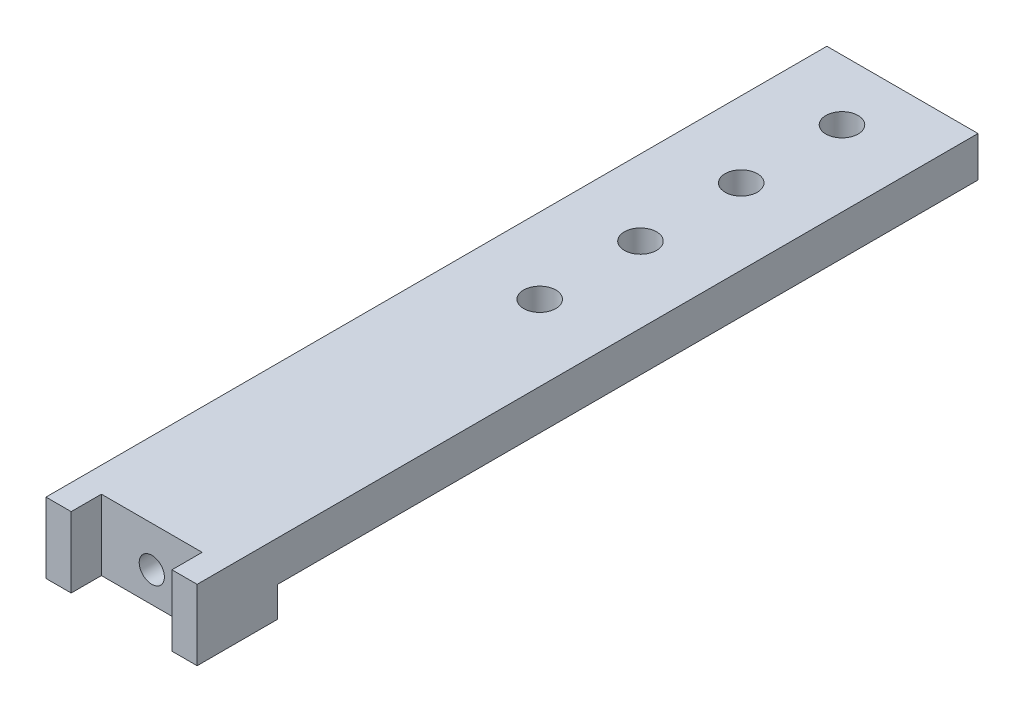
SolidWorks part; units mm, degrees
ref_plane "前视基准面" through (0, 0, 0) normal (0, 0, 1) x (1, 0, 0)
ref_plane "上视基准面" through (0, 0, 0) normal (0, 1, 0) x (1, 0, 0)
ref_plane "右视基准面" through (0, 0, 0) normal (1, 0, 0) x (0, 0, -1)
sketch "草图1" plane through (0, 0, 0) normal (0, 1, 0) x (1, 0, 0)
  line L1 (-7.5, 37.25) -> (7.5, 37.25)
  line L2 (-7.5, 37.25) -> (-7.5, -37.25)
  line L3 (-7.5, -37.25) -> (7.5, -37.25)
  line L4 (7.5, 37.25) -> (7.5, -37.25)
  line L5 (-7.5, 37.25) -> (7.5, -37.25) construction
  line L6 (-7.5, -37.25) -> (7.5, 37.25) construction
  point P0 (0, 0)
  dimension "D1" = 15
  dimension "D2" = 74.5
extrude "凸台-拉伸1" add sketch "草图1" along normal blind 4
sketch "草图2" plane through (0, 0, 0) normal (0, 1, 0) x (1, 0, 0)
  line L1 (-5, 37.25) -> (5, 37.25)
  line L2 (-5, 37.25) -> (-5, -2.75)
  line L3 (-5, -2.75) -> (5, -2.75)
  line L4 (5, 37.25) -> (5, -2.75)
  line L5 (-5, 37.25) -> (5, -2.75) construction
  line L6 (-5, -2.75) -> (5, 37.25) construction
  line L7 (7.5, 37.25) -> (-7.5, 37.25) construction
  point P0 (0, 17.25)
  dimension "D1" = 10
  dimension "D2" = 40
extrude "凸台-拉伸2" add sketch "草图2" against normal blind 1
sketch "草图3" plane through (0, 0, 0) normal (0, -1, 0) x (1, 0, 0)
  line L0 (-7.5, -37.25) -> (-7.5, 37.25) construction
  line L1 (7.5, 37.25) -> (-7.5, 37.25)
  line L2 (7.5, 37.25) -> (7.5, 32.25)
  line L3 (7.5, 32.25) -> (-7.5, 32.25)
  line L4 (-7.5, 37.25) -> (-7.5, 32.25)
  dimension "D1" = 5
extrude "凸台-拉伸3" add sketch "草图3" along normal blind 3
sketch "草图4" plane through (0, 0, 37.25) normal (0, 0, 1) x (1, 0, 0)
  line L0 (-7.5, 4) -> (7.5, 4) construction
  line L1 (7.5, -3) -> (5, -3)
  line L2 (7.5, -3) -> (7.5, 4)
  line L3 (7.5, 4) -> (5, 4)
  line L4 (5, -3) -> (5, 4)
  line L6 (-7.5, -3) -> (-5, -3)
  line L7 (-7.5, -3) -> (-7.5, 4)
  line L8 (-7.5, 4) -> (-5, 4)
  line L9 (-5, -3) -> (-5, 4)
  dimension "D1" = 2.5
extrude "凸台-拉伸4" add sketch "草图4" along normal blind 3
sketch "草图5" plane through (0, -1, 0) normal (0, -1, 0) x (1, 0, 0)
  line L0 (0, 27.9404) -> (0, -52.3159) construction
  line L1 (5, -37.25) -> (-5, -37.25) construction
  circle A0 centre (0, -31.25) radius 1.6
  circle A1 centre (0, -21.25) radius 1.6
  circle A2 centre (0, -11.25) radius 1.6
  circle A3 centre (0, -1.25) radius 1.6
  dimension "D1" = 3.2
  dimension "D2" = 6
  dimension "D3" = 10
  dimension "D4" = 10
  dimension "D5" = 10
extrude "切除-拉伸1" cut sketch "草图5" against normal blind 5
sketch "草图6" plane through (0, 0, 37.25) normal (0, 0, 1) x (1, 0, 0)
  circle A0 centre (0, 0) radius 1.25
  dimension "D1" = 2.5
extrude "切除-拉伸2" cut sketch "草图6" against normal up to surface (5 mm away)
